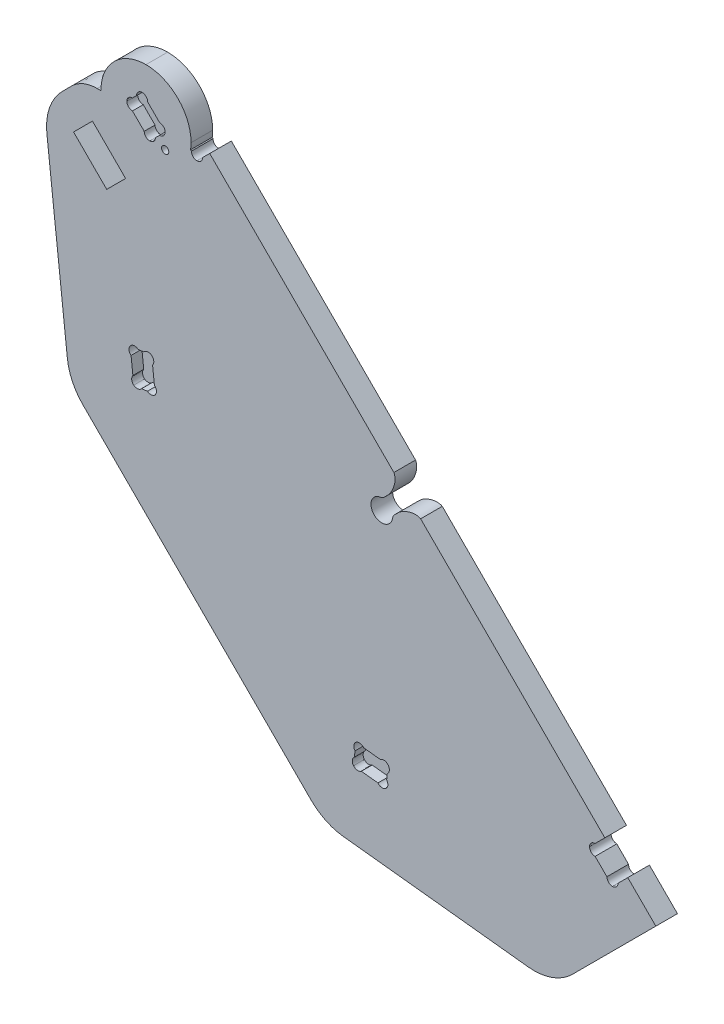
SolidWorks part; units mm, degrees
ref_plane "Plan de face" through (0, 0, 0) normal (0, 0, 1) x (1, 0, 0)
ref_plane "Plan de dessus" through (0, 0, 0) normal (0, 1, 0) x (1, 0, 0)
ref_plane "Plan de droite" through (0, 0, 0) normal (1, 0, 0) x (0, 0, -1)
body saved out of another part "Stock-Pièce3-1"
sketch "Esquisse1" plane through (0, 0, 0) normal (0, 0, -1) x (-1, 0, 0)
  line L13 (-2135.6517, 188.8286) -> (-2135.8694, 188.6109)
  line L14 (-2138.9694, 188.6109) -> (-2140.955, 190.5964)
  line L15 (-2140.955, 190.5964) -> (-2250.5565, 80.9949)
  line L16 (-2250.5565, 80.9949) -> (-2247.8639, 78.3022)
  line L17 (-2247.8639, 75.2022) -> (-2251.1278, 71.9383)
  line L18 (-2254.2278, 71.9383) -> (-2256.9205, 74.6309)
  line L19 (-2256.9205, 74.6309) -> (-2264.6987, 66.8527)
  line L20 (-2264.6987, 66.8527) -> (-2241.5122, 43.6662)
  line L21 (-2229.2491, 39.3646) -> (-2178.0043, 45.0585)
  line L22 (-2169.0542, 49.3601) -> (-2105.7847, 112.6296)
  line L23 (-2101.483, 121.5797) -> (-2095.7892, 172.8245)
  line L24 (-2100.0908, 185.0876) -> (-2102.6707, 187.6675)
  line L25 (-2109.7418, 190.5964) -> (-2110.7773, 190.5964)
  line L26 (-2135.6517, 188.8286) -> (-2135.8694, 188.6109)
  line L27 (-2138.9694, 188.6109) -> (-2140.955, 190.5964)
  line L28 (-2140.955, 190.5964) -> (-2250.5565, 80.9949)
  line L29 (-2250.5565, 80.9949) -> (-2247.8639, 78.3022)
  line L30 (-2247.8639, 75.2022) -> (-2251.1278, 71.9383)
  line L31 (-2254.2278, 71.9383) -> (-2256.9205, 74.6309)
  line L32 (-2256.9205, 74.6309) -> (-2264.6987, 66.8527)
  line L33 (-2264.6987, 66.8527) -> (-2241.5122, 43.6662)
  line L34 (-2229.2491, 39.3646) -> (-2178.0043, 45.0585)
  line L35 (-2169.0542, 49.3601) -> (-2105.7847, 112.6296)
  line L36 (-2101.483, 121.5797) -> (-2095.7892, 172.8245)
  line L37 (-2100.0908, 185.0876) -> (-2102.6707, 187.6675)
  line L38 (-2109.7418, 190.5964) -> (-2110.7773, 190.5964)
  arc A1 (-2135.7773, 190.5964) -> (-2135.6517, 188.8286) centre (-2123.2773, 190.5964) ccw
  arc A2 (-2135.7773, 190.5964) -> (-2135.6517, 188.8286) centre (-2123.2773, 190.5964) ccw
  spline S13 degree 3 poles (-3490.4757, -2449.9373) (-200.5641, 2561.3135) (-4493.9706, -1732.0816) (517.1565, 1557.7292) knots 17.604709 17.604709 17.604709 17.604709 33.395186 33.395186 33.395186 33.395186 only from (-2123.2773, 203.0964) to (-2135.7773, 190.5964)
  spline S14 degree 3 poles (-4552.3791, -1582.9482) (100.109, 2208.7505) (-4157.5549, -2048.9142) (-365.8703, 2603.5584) knots 6.644816 6.644816 6.644816 6.644816 38.355157 38.355157 38.355157 38.355157 only from (-2135.8694, 188.6109) to (-2137.4194, 187.0609)
  spline S15 degree 3 poles (-3908.9785, 2603.5706) (-117.2798, -2048.9176) (-4374.9445, 2208.7464) (277.528, -1582.9382) knots 5.644816 5.644816 5.644816 5.644816 37.355157 37.355157 37.355157 37.355157 only from (-2137.4194, 187.0609) to (-2138.9694, 188.6109)
  spline S16 degree 3 poles (-476.3048, -2338.2075) (-4268.0035, 2314.2807) (-10.3388, -1943.3833) (-4662.8114, 1848.3013) knots 1.644816 1.644816 1.644816 1.644816 33.355157 33.355157 33.355157 33.355157 only from (-2247.8639, 78.3022) to (-2246.3139, 76.7522)
  spline S17 degree 3 poles (-4662.8236, -1694.8068) (-10.3354, 2096.8918) (-4267.9994, -2160.7729) (-476.3148, 2491.6997) knots 0.644816 0.644816 0.644816 0.644816 32.355157 32.355157 32.355157 32.355157 only from (-2246.3139, 76.7522) to (-2247.8639, 75.2022)
  spline S18 degree 3 poles (-4667.6375, -1699.6208) (-15.1494, 2092.0779) (-4272.8134, -2165.5868) (-481.1288, 2486.8857) knots -1.355184 -1.355184 -1.355184 -1.355184 30.355157 30.355157 30.355157 30.355157 only from (-2251.1278, 71.9383) to (-2252.6778, 70.3883)
  spline S19 degree 3 poles (-4024.2369, 2486.8979) (-232.5382, -2165.5902) (-4490.2029, 2092.0738) (162.2696, -1699.6108) knots -2.355184 -2.355184 -2.355184 -2.355184 29.355157 29.355157 29.355157 29.355157 only from (-2252.6778, 70.3883) to (-2254.2278, 71.9383)
  spline S20 degree 3 poles (739.0457, 59.5511) (-5207.7618, 728.2768) (514.6714, -1279.0453) (-4546.7406, 1913.7021) knots -3.514735 -3.514735 -3.514735 -3.514735 22.514718 22.514718 22.514718 22.514718 only from (-2241.5122, 43.6662) to (-2229.2491, 39.3646)
  spline S21 degree 3 poles (-88.0047, 2169.4162) (-4759.2872, -1570.1089) (704.7069, 1056.0262) (-5133.5548, -255.5894) knots -9.781901 -9.781901 -9.781901 -9.781901 24.781987 24.781987 24.781987 24.781987 only from (-2178.0043, 45.0585) to (-2169.0542, 49.3601)
  spline S22 degree 3 poles (-1800.845, 3077.0867) (-3112.441, -2761.1188) (-486.312, 2702.8782) (-4225.8687, -1968.4547) knots -11.781901 -11.781901 -11.781901 -11.781901 22.781987 22.781987 22.781987 22.781987 only from (-2105.7847, 112.6296) to (-2101.483, 121.5797)
  spline S23 degree 3 poles (-3970.1329, 2490.326) (-777.3787, -2571.1001) (-2784.6992, 3151.3336) (-2115.977, -2795.4586) knots -9.514735 -9.514735 -9.514735 -9.514735 16.514718 16.514718 16.514718 16.514718 only from (-2095.7892, 172.8245) to (-2100.0908, 185.0876)
  spline S24 degree 3 poles (-5074.99, 465.9461) (801.9363, -696.7266) (-4788.9841, 1619.1056) (188.8118, -1714.4006) knots -15.511298 -15.511298 -15.511298 -15.511298 18.511375 18.511375 18.511375 18.511375 only from (-2102.6707, 187.6675) to (-2109.7418, 190.5964)
  spline S25 degree 3 poles (-4763.811, 1557.7948) (247.4398, -1732.1168) (-4045.9553, 2561.2897) (-756.1445, -2449.8374) knots 18.604709 18.604709 18.604709 18.604709 34.395186 34.395186 34.395186 34.395186 only from (-2110.7773, 190.5964) to (-2123.2773, 203.0964)
  spline S26 degree 3 poles (-2123.2773, 203.0964) (-2130.1809, 203.0964) (-2135.7773, 197.5) (-2135.7773, 190.5964) knots 25 25 25 25 26 26 26 26
  spline S27 degree 3 poles (-2135.8694, 188.6109) (-2135.8694, 187.7548) (-2136.5634, 187.0609) (-2137.4194, 187.0609) knots 22 22 22 22 23 23 23 23
  spline S28 degree 3 poles (-2137.4194, 187.0609) (-2138.2755, 187.0609) (-2138.9694, 187.7548) (-2138.9694, 188.6109) knots 21 21 21 21 22 22 22 22
  spline S29 degree 3 poles (-2247.8639, 78.3022) (-2247.0078, 78.3022) (-2246.3139, 77.6083) (-2246.3139, 76.7522) knots 17 17 17 17 18 18 18 18
  spline S30 degree 3 poles (-2246.3139, 76.7522) (-2246.3139, 75.8962) (-2247.0078, 75.2022) (-2247.8639, 75.2022) knots 16 16 16 16 17 17 17 17
  spline S31 degree 3 poles (-2251.1278, 71.9383) (-2251.1278, 71.0822) (-2251.8218, 70.3883) (-2252.6778, 70.3883) knots 14 14 14 14 15 15 15 15
  spline S32 degree 3 poles (-2252.6778, 70.3883) (-2253.5339, 70.3883) (-2254.2278, 71.0822) (-2254.2278, 71.9383) knots 13 13 13 13 14 14 14 14
  spline S33 degree 3 poles (-2241.5122, 43.6662) (-2238.2901, 40.4441) (-2233.778, 38.8614) (-2229.2491, 39.3646) knots 9 9 9 9 10 10 10 10
  spline S34 degree 3 poles (-2178.0043, 45.0585) (-2174.6191, 45.4346) (-2171.4626, 46.9517) (-2169.0542, 49.3601) knots 7 7 7 7 8 8 8 8
  spline S35 degree 3 poles (-2105.7847, 112.6296) (-2103.3762, 115.0381) (-2101.8592, 118.1945) (-2101.483, 121.5797) knots 5 5 5 5 6 6 6 6
  spline S36 degree 3 poles (-2095.7892, 172.8245) (-2095.286, 177.3534) (-2096.8687, 181.8655) (-2100.0908, 185.0876) knots 3 3 3 3 4 4 4 4
  spline S37 degree 3 poles (-2102.6707, 187.6675) (-2104.5461, 189.5428) (-2107.0896, 190.5964) (-2109.7418, 190.5964) knots 1 1 1 1 2 2 2 2
  spline S38 degree 3 poles (-2110.7773, 190.5964) (-2110.7773, 197.5) (-2116.3737, 203.0964) (-2123.2773, 203.0964) knots 26 26 26 26 27 27 27 27
  dimension "D1" = 0
extrude "Boss.-Extru.1" add sketch "Esquisse1" against normal blind 3 contours L38 S38 S26 A2 L26 S27 S28 L27 L28 L29 S29 S30 L30 S31 S32 L31 L32 L33 S33 L34 S34 L35 S35 L36 S36 L37 S37
sketch "Esquisse3" plane through (0, 0, 6) normal (0, 0, 1) x (1, 0, 0)
  line L0 (2104.7436, 175.3266) -> (2108.0075, 172.0627) construction
  line L1 (2111.1075, 172.0627) -> (2113.248, 174.2031) construction
  line L2 (2113.248, 177.3031) -> (2109.984, 180.5671) construction
  line L3 (2106.884, 180.5671) -> (2104.7436, 178.4266) construction
  line L4 (2104.7436, 175.3266) -> (2108.0075, 172.0627)
  line L5 (2111.1075, 172.0627) -> (2113.248, 174.2031)
  line L6 (2113.248, 177.3031) -> (2109.984, 180.5671)
  line L7 (2106.884, 180.5671) -> (2104.7436, 178.4266)
  spline S0 degree 3 poles (1828.4862, 2160.2125) (2035.4888, 106.7567) (2135.7621, 179.5258) (2122.85, 192.4379) (2050.0816, 92.1657) (4103.505, -114.8348) knots -15.531712 -15.531712 -15.531712 -15.531712 1 1 17.531627 17.531627 17.531627 17.531627 only from (2129.306, 184.5677) to (2127.8918, 185.9819) construction
  spline S1 degree 3 poles (2428.7117, -1789.6629) (2221.7091, 263.7928) (2121.4358, 191.0237) (2134.3478, 178.1117) (2207.1163, 278.3839) (153.6928, 485.3843) knots -13.531712 -13.531712 -13.531712 -13.531712 3 3 19.531627 19.531627 19.531627 19.531627 only from (2127.8918, 185.9819) to (2129.306, 184.5677) construction
  spline S2 degree 3 poles (959.7272, -1458.6999) (3442.9152, 1681.4947) (600.1114, -1161.3127) (3740.3722, 1321.9342) knots -3.351802 -3.351802 -3.351802 -3.351802 24.351955 24.351955 24.351955 24.351955 only from (2104.7436, 178.4266) to (2103.1936, 176.8766) construction
  spline S3 degree 3 poles (3740.3201, -968.1397) (600.1255, 1515.0483) (3442.9329, -1327.7555) (959.686, 1812.5052) knots -4.351802 -4.351802 -4.351802 -4.351802 23.351955 23.351955 23.351955 23.351955 only from (2103.1936, 176.8766) to (2104.7436, 175.3266) construction
  spline S4 degree 3 poles (3745.1341, -972.9537) (604.9395, 1510.2343) (3447.7469, -1332.5695) (964.5, 1807.6913) knots -6.351802 -6.351802 -6.351802 -6.351802 21.351955 21.351955 21.351955 21.351955 only from (2108.0075, 172.0627) to (2109.5575, 170.5127) construction
  spline S5 degree 3 poles (3254.5739, 1807.6392) (771.3859, -1332.5554) (3614.1897, 1510.252) (473.9289, -972.9949) knots -7.351802 -7.351802 -7.351802 -7.351802 20.351955 20.351955 20.351955 20.351955 only from (2109.5575, 170.5127) to (2111.1075, 172.0627) construction
  spline S6 degree 3 poles (3258.2643, 1811.3296) (775.0763, -1328.8649) (3617.8801, 1513.9425) (477.6194, -969.3044) knots -9.351802 -9.351802 -9.351802 -9.351802 18.351955 18.351955 18.351955 18.351955 only from (2113.248, 174.2031) to (2114.798, 175.7531) construction
  spline S7 degree 3 poles (477.6715, 1320.7695) (3617.866, -1162.4185) (775.0586, 1680.3853) (3258.3055, -1459.8755) knots -10.351802 -10.351802 -10.351802 -10.351802 17.351955 17.351955 17.351955 17.351955 only from (2114.798, 175.7531) to (2113.248, 177.3031) construction
  spline S8 degree 3 poles (472.8575, 1325.5834) (3613.0521, -1157.6046) (770.2447, 1685.1992) (3253.4916, -1455.0615) knots -12.351802 -12.351802 -12.351802 -12.351802 15.351955 15.351955 15.351955 15.351955 only from (2109.984, 180.5671) to (2108.434, 182.1171) construction
  spline S9 degree 3 poles (963.4177, -1455.0094) (3446.6057, 1685.1851) (603.8019, -1157.6223) (3744.0626, 1325.6246) knots -13.351802 -13.351802 -13.351802 -13.351802 14.351955 14.351955 14.351955 14.351955 only from (2108.434, 182.1171) to (2106.884, 180.5671) construction
  spline S10 degree 3 poles (2129.306, 184.5677) (2129.6966, 184.9582) (2129.6966, 185.5914) (2128.9155, 186.3724) (2128.2824, 186.3724) (2127.8918, 185.9819) knots 0 0 0 0 1 1 2 2 2 2
  spline S11 degree 3 poles (2127.8918, 185.9819) (2127.5013, 185.5914) (2127.5013, 184.9582) (2128.2824, 184.1771) (2128.9155, 184.1771) (2129.306, 184.5677) knots 2 2 2 2 3 3 4 4 4 4
  spline S12 degree 3 poles (2104.7436, 178.4266) (2103.8875, 178.4266) (2103.1936, 177.7327) (2103.1936, 176.8766) knots 10 10 10 10 11 11 11 11
  spline S13 degree 3 poles (2103.1936, 176.8766) (2103.1936, 176.0206) (2103.8875, 175.3266) (2104.7436, 175.3266) knots 9 9 9 9 10 10 10 10
  spline S14 degree 3 poles (2108.0075, 172.0627) (2108.0075, 171.2066) (2108.7015, 170.5127) (2109.5575, 170.5127) knots 7 7 7 7 8 8 8 8
  spline S15 degree 3 poles (2109.5575, 170.5127) (2110.4136, 170.5127) (2111.1075, 171.2066) (2111.1075, 172.0627) knots 6 6 6 6 7 7 7 7
  spline S16 degree 3 poles (2113.248, 174.2031) (2114.104, 174.2031) (2114.798, 174.8971) (2114.798, 175.7531) knots 4 4 4 4 5 5 5 5
  spline S17 degree 3 poles (2114.798, 175.7531) (2114.798, 176.6092) (2114.104, 177.3031) (2113.248, 177.3031) knots 3 3 3 3 4 4 4 4
  spline S18 degree 3 poles (2109.984, 180.5671) (2109.984, 181.4231) (2109.2901, 182.1171) (2108.434, 182.1171) knots 1 1 1 1 2 2 2 2
  spline S19 degree 3 poles (2108.434, 182.1171) (2107.578, 182.1171) (2106.884, 181.4231) (2106.884, 180.5671) knots 0 0 0 0 1 1 1 1
extrude "Enlèv. mat.-Extru.1" cut sketch "Esquisse3" against normal blind 51
sketch "Esquisse4" plane through (0, 0, 6) normal (0, 0, 1) x (1, 0, 0)
  line L0 (2195.7558, 135.7956) -> (2179.6374, 119.6773) construction
  line L1 (2250.5565, 80.9949) -> (2140.955, 190.5964) construction
  line L2 (2190.806, 126.6032) -> (2202.3957, 138.1929) construction
  line L3 (2191.1468, 128.3583) -> (2199.7244, 136.9358) construction
  line L4 (2190.987, 121.8052) -> (2191.9689, 131.3263) construction
  line L5 (2199.4628, 132.0886) -> (2200.8008, 133.4267)
  line L6 (2200.8008, 133.4267) -> (2193.3493, 140.8783)
  line L7 (2193.3493, 140.8783) -> (2192.0488, 139.5026)
  arc A0 (2188.0516, 131.657) -> (2191.6171, 128.0915) centre (2188.6847, 128.7246) ccw
  spline S0 degree 3 poles (2191.6171, 128.0915) (2191.7712, 129.1451) (2192.3264, 129.505) (2194.2334, 131.4937) (2197.6886, 133.0028) (2199.4628, 132.0886) knots 0 0 0 0 0.417401 0.517401 1 1 1 1
  spline S1 degree 3 poles (2188.0516, 131.657) (2189.1052, 131.8111) (2189.4651, 132.3662) (2191.4538, 134.2732) (2192.9629, 137.7285) (2192.0488, 139.5026) knots 0 0 0 0 0.417401 0.517401 1 1 1 1
  dimension "D1" = 6
  dimension "D2" = 10
  dimension "D3" = 1
extrude "Enlèv. mat.-Extru.2" cut sketch "Esquisse4" against normal through all
sketch "Esquisse5" plane through (0, 0, 6) normal (0, 0, 1) x (1, 0, 0)
  line L0 (2105.8138, 179.4969) -> (2120.9264, 164.3843) construction
  line L7 (2103.1936, 176.8766) -> (2108.434, 182.1171)
  line L16 (2117.6264, 172.9247) -> (2108.434, 182.1171)
  line L18 (2112.386, 167.6842) -> (2117.6264, 172.9247)
  line L19 (2113.248, 174.2031) -> (2111.1075, 172.0627) construction
  line L20 (2104.7436, 178.4266) -> (2106.884, 180.5671) construction
  line L21 (2112.386, 167.6842) -> (2103.1936, 176.8766)
  point P1 (2118.2855, 172.2656)
  point P5 (2115.0062, 170.3045)
  dimension "D1" = 4
extrude "Enlèv. mat.-Extru.3" cut sketch "Esquisse5" against normal through all
sketch "Esquisse6" plane through (0, 0, 6) normal (0, 0, 1) x (1, 0, 0)
  line L0 (2117.6264, 172.9247) -> (2112.386, 167.6842)
  line L5 (2103.1936, 176.8766) -> (2108.434, 182.1171)
  line L6 (2104.7436, 178.4266) -> (2106.884, 180.5671) construction
  line L7 (2117.6264, 172.9247) -> (2108.434, 182.1171)
  line L8 (2112.386, 167.6842) -> (2103.1936, 176.8766)
  line L9 (2117.6264, 172.9247) -> (2114.798, 175.7531) construction
  line L10 (2105.8138, 179.4969) -> (2115.0062, 170.3045) construction
  line L11 (2112.386, 167.6842) -> (2117.6264, 172.9247) construction
  line L12 (2120.4548, 172.9247) -> (2108.434, 184.9455)
  line L13 (2100.3651, 176.8766) -> (2108.434, 184.9455)
  line L14 (2112.386, 164.8558) -> (2100.3651, 176.8766)
  line L15 (2120.4548, 172.9247) -> (2112.386, 164.8558)
  point P5 (2117.6264, 172.9247)
  dimension "D1" = 2
extrude "Boss.-Extru.2" add sketch "Esquisse6" against normal up to surface (6 mm away)
